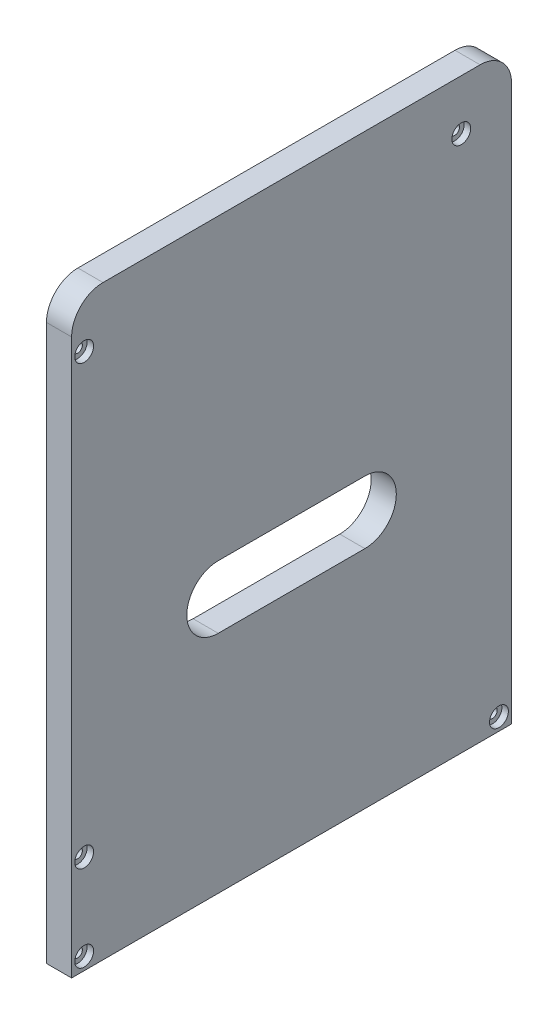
SolidWorks part; units mm, degrees
ref_plane "Front Plane" through (0, 0, 0) normal (0, 0, 1) x (1, 0, 0)
ref_plane "Top Plane" through (0, 0, 0) normal (0, 1, 0) x (1, 0, 0)
ref_plane "Right Plane" through (0, 0, 0) normal (1, 0, 0) x (0, 0, -1)
body saved out of another part "Stock-Donut Shop-1"
hole_wizard "CBORE for M4 Pan Head Machine Screw2" positions "3DSketch2" profile "Sketch2" counterbore size "M4" standard "ANSI Metric"
sketch3d "3DSketch2"
  point P0 (240, 256, 99)
  point P3 (240, 256, -81)
  point P6 (240, 47, 99)
  point P9 (240, 6, 99)
  point P12 (240, 6, -99)
sketch "Sketch2" plane through (240, 256, 99) normal (0, 1, 0) x (0, 0, -1)
  line L0 (0, 0) -> (0, 30)
  line L1 (0, 30) -> (2.25, 28.6481)
  line L2 (2.25, 28.6481) -> (2.25, 3.1)
  line L3 (2.25, 3.1) -> (4.5, 3.1)
  line L4 (4.5, 3.1) -> (4.5, 0)
  line L5 (4.5, 0) -> (0, 0)
  line L6 (0, 30) -> (-2.25, 28.6481) construction
  line L7 (0, -6.35) -> (0, 107.95) construction
  dimension "Hole Dia." = 4.5
  dimension "Hole Depth" = 30
  dimension "C'Bore Dia." = 9
  dimension "C'Bore Depth" = 3.1
  dimension "Drill Angle" = 118
